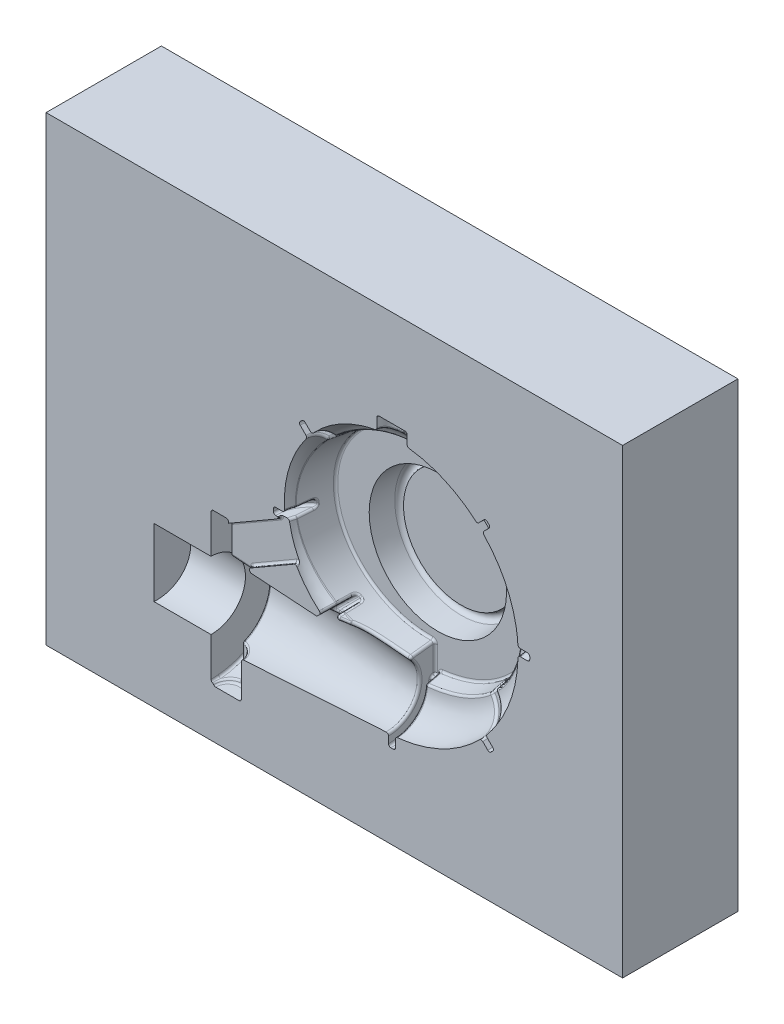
SolidWorks part; units mm, degrees
ref_plane "Plan de face" through (0, 0, 0) normal (0, 0, 1) x (1, 0, 0)
ref_plane "Plan de dessus" through (0, 0, 0) normal (0, 1, 0) x (1, 0, 0)
ref_plane "Plan de droite" through (0, 0, 0) normal (1, 0, 0) x (0, 0, -1)
sketch "Esquisse2" plane through (0, 0, 0) normal (0, 0, 1) x (1, 0, 0)
  line L1 (200, 200) -> (-300, 200)
  line L2 (200, 200) -> (200, -200)
  line L3 (200, -200) -> (-300, -200)
  line L4 (-300, 200) -> (-300, -200)
  dimension "D1" = 200
  dimension "D2" = 200
  dimension "D3" = 200
  dimension "D4" = 300
extrude "Extrusion1" add sketch "Esquisse2" against normal blind 100
other "Empreinte1"
other "MODELE<1>@E D M1"
